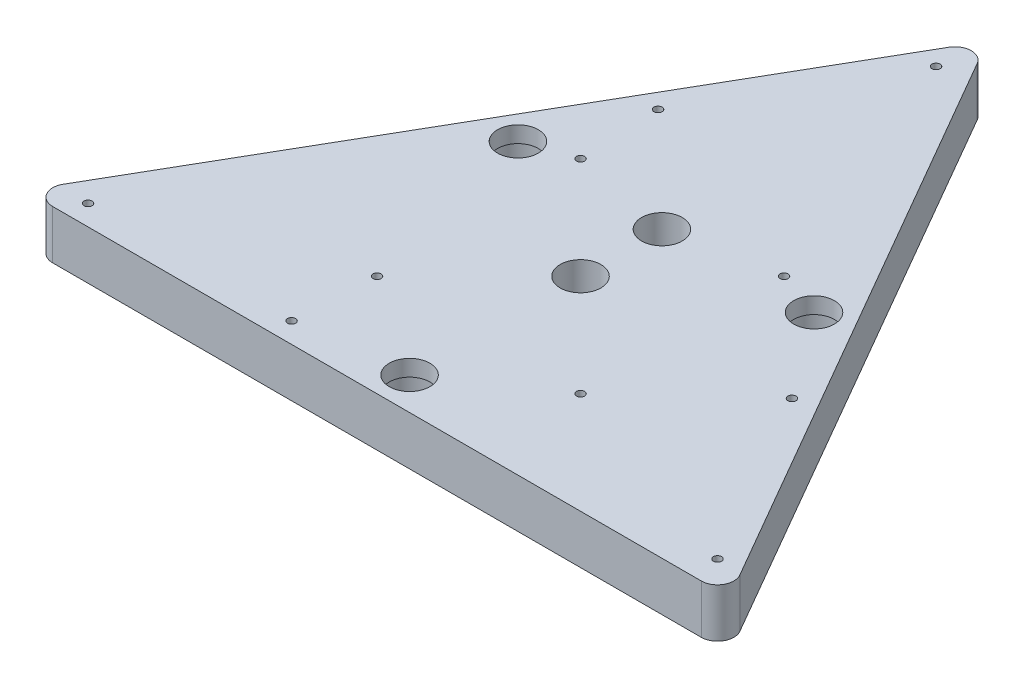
SolidWorks part; units mm, degrees
ref_plane "Plan de face" through (0, 0, 0) normal (0, 0, 1) x (1, 0, 0)
ref_plane "Plan de dessus" through (0, 0, 0) normal (0, 1, 0) x (1, 0, 0)
ref_plane "Plan de droite" through (0, 0, 0) normal (1, 0, 0) x (0, 0, -1)
sketch "Esquisse1" plane through (0, 0, 0) normal (0, 1, 0) x (1, 0, 0)
  line L0 (-39.2989, 50) -> (59.2636, 50) construction
  line L1 (0, -44.868) -> (0, 70.0866) construction
  line L2 (0, 0) -> (-64.6644, -37.334) construction
  line L3 (0, 50) -> (-43.3013, -25)
  line L4 (-43.3013, -25) -> (43.3013, -25)
  line L5 (0, 50) -> (43.3013, -25)
  line L6 (0, 0) -> (68.357, 39.4659) construction
  line L7 (0, 0) -> (-63.4066, 36.6078) construction
  line L8 (-43.3013, -14.5081) -> (-43.3013, -36.1962) construction
  line L9 (-57.4914, -25.3522) -> (-36.6562, -25) construction
  circle A0 centre (0, 0) radius 50 construction
  circle A1 centre (0, 0) radius 2.5
  circle A2 centre (-18.1865, 10.5) radius 2.5
  circle A3 centre (0, -21) radius 2.5
  circle A4 centre (18.1865, 10.5) radius 2.5
  circle A5 centre (38.4856, -21.659) radius 0.5
  circle A6 centre (25.9856, -0.0083) radius 0.5
  circle A7 centre (-0.4856, 44.159) radius 0.5
  circle A8 centre (-12.9856, 22.5083) radius 0.5
  circle A9 centre (0, 10) radius 2.5
  circle A10 centre (-38, -22.5) radius 0.5
  circle A11 centre (-13, -22.5) radius 0.5
  circle A12 centre (12.5, 12.5) radius 0.5
  circle A13 centre (-12.5, 12.5) radius 0.5
  circle A14 centre (-12.5, -12.5) radius 0.5
  circle A15 centre (12.5, -12.5) radius 0.5
  point P12 (0, -25)
  dimension "D2" = 60
  dimension "D1" = 120
  dimension "D3" = 60
extrude "Extrusion1" add sketch "Esquisse1" against normal blind 6
fillet "Congé1" radius 2 3 edges at (43.3013, -3, 25) (-43.3013, -3, 25) (0, -3, -50)
sketch "Esquisse2" plane through (0, -6, 0) normal (0, 1, 0) x (-1, 0, 0)
  circle A0 centre (0, 20.984) radius 3.25
  circle A1 centre (-18.1727, -10.492) radius 3.25
  circle A2 centre (18.1727, -10.492) radius 3.25
extrude "Enlèv. mat.-Extru.1" cut sketch "Esquisse2" along normal blind 4
sketch "Esquisse3" plane through (0, 0, 0) normal (1, 0, 0) x (0, 0, -1)
  line L0 (10.5243, 2.8595) -> (10.5243, -10.6768) construction
  line L1 (9.4799, 2.8595) -> (9.4799, -8.4208) construction
